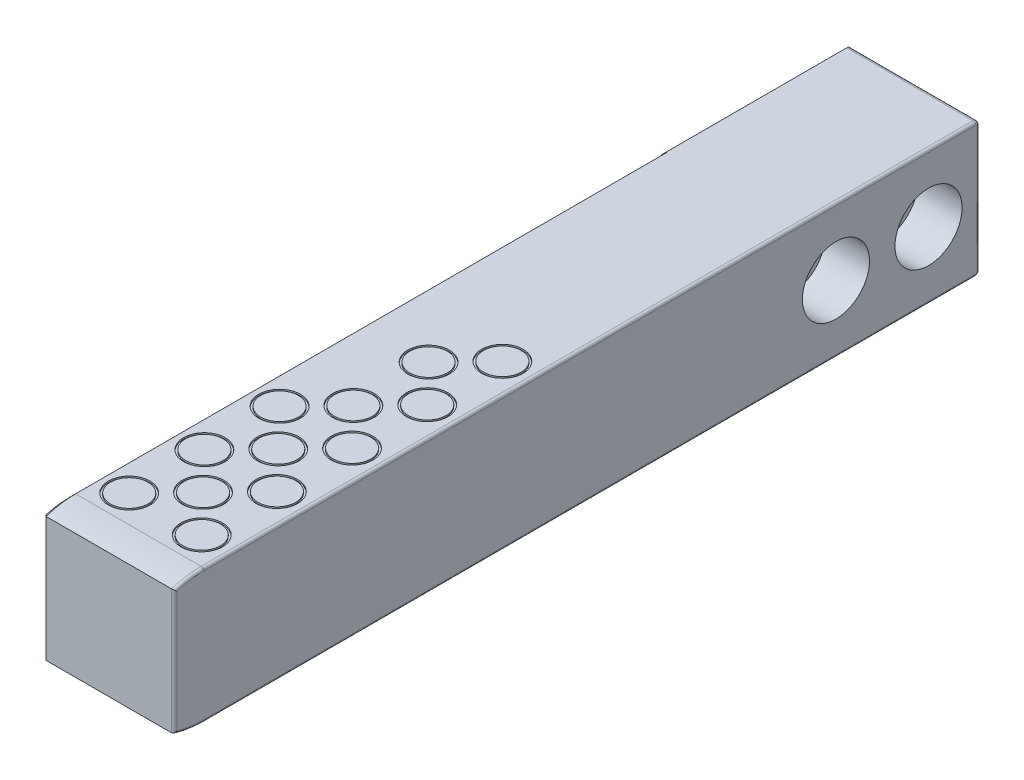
SolidWorks part; units mm, degrees
ref_plane "Front Plane" through (0, 0, 0) normal (0, 0, 1) x (1, 0, 0)
ref_plane "Top Plane" through (0, 0, 0) normal (0, 1, 0) x (1, 0, 0)
ref_plane "Right Plane" through (0, 0, 0) normal (1, 0, 0) x (0, 0, -1)
sketch "Sketch1" plane through (0, 0, 0) normal (1, 0, 0) x (0, 0, -1)
  line L0 (0, 0) -> (-117.475, 0) construction
  line L1 (-111.887, -12.7) -> (34.163, -12.7)
  line L2 (-117.475, -11.7991) -> (-117.475, 11.7991)
  line L3 (-111.887, 12.7) -> (34.163, 12.7)
  line L4 (34.925, -11.938) -> (34.925, 11.938)
  line L5 (0, 0) -> (-13.4495, 0) construction
  arc A0 (34.163, -12.7) -> (34.925, -11.938) centre (34.163, -11.938) ccw
  arc A1 (34.163, 12.7) -> (34.925, 11.938) centre (34.163, 11.938) cw
  arc A2 (-111.887, 12.7) -> (-117.475, 11.7991) centre (-111.887, -5.08) ccw
  arc A3 (-111.887, -12.7) -> (-117.475, -11.7991) centre (-111.887, 5.08) cw
  circle A6 centre (25.273, 0) radius 4.318
  circle A7 centre (7.747, 0) radius 4.318
  point P17 (-117.475, -11.7991)
  point P20 (-117.475, 11.7991)
  dimension "D5" = 0.762
  dimension "D9" = 17.78
  dimension "D7" = 8.636
  dimension "D10" = 8.636
  dimension "D2" = 152.4
  dimension "D3" = 34.925
  dimension "D6" = 5.588
  dimension "D8" = 9.652
  dimension "D11" = 17.526
  dimension "D12" = 25.4
extrude "Boss-Extrude1" add sketch "Sketch1" against normal blind 25.4
sketch "Sketch2" plane through (0, 12.7, 0) normal (0, 1, 0) x (1, 0, 0)
  line L0 (-25.4, 34.163) -> (-25.4, -111.887) construction
  line L1 (0, 34.163) -> (0, -111.887) construction
  line L2 (-12.446, -99.568) -> (5.5051, -99.568) construction
  line L3 (-5.588, -92.456) -> (-28.5049, -92.456) construction
  line L4 (-12.446, -85.344) -> (3.2168, -85.344) construction
  circle A0 centre (-19.304, -106.68) radius 3.937
  circle A1 centre (-19.304, -106.68) radius 3.556
  circle A2 centre (-12.446, -99.568) radius 3.937
  circle A3 centre (-12.446, -99.568) radius 3.556
  circle A4 centre (-5.588, -106.68) radius 3.556
  circle A5 centre (-5.588, -106.68) radius 3.937
  circle A6 centre (-5.588, -92.456) radius 3.937
  circle A7 centre (-5.588, -92.456) radius 3.556
  circle A8 centre (-12.446, -85.344) radius 3.556
  circle A9 centre (-12.446, -85.344) radius 3.937
  circle A10 centre (-5.588, -78.232) radius 3.556
  circle A11 centre (-5.588, -78.232) radius 3.937
  dimension "D1" = 106.68
  dimension "D2" = 5.588
  dimension "D5" = 7.874
  dimension "D7" = 12.954
  dimension "D8" = 7.112
  dimension "D3" = 7.112
  dimension "D4" = 6.858
  dimension "D9" = 12.446
  dimension "D6" = 6.858
extrude "Cut-Extrude1" cut sketch "Sketch2" against normal blind 0.2794
pattern_linear "LPattern2" count 3 spacing 14.224 along (0, 0, -1) of "Cut-Extrude1"
mirror "Mirror1" about plane through (0, 0, 0) normal (0, 1, 0) of "LPattern2", "Cut-Extrude1"
fillet "Fillet3" radius 0.508 10 edges at (0, 0, 117.475) (0, 12.4733, 114.7171) (0, 12.7, 38.862) (0, 12.4768, -34.7018) (0, 0, -34.925) (0, -12.4768, -34.7018) (0, -12.7, 38.862) (0, -12.4733, 114.7171) (0, 0, -29.591) (0, 0, -12.065)
ref_plane "Plane1" through (0, 0, -44.45) normal (0, 0, 1) x (1, 0, 0)
ref_plane "Plane2" through (0, 0, -15.875) normal (0, 0, 1) x (1, 0, 0)
sketch "Sketch4" plane through (0, 0, 0) normal (0, 1, 0) x (1, 0, 0)
  line L0 (-25.4, 25.273) -> (-0.508, 25.273) construction
  line L2 (-8.382, 25.273) -> (0, 25.273)
  line L4 (-8.382, 25.273) -> (-8.382, 31.623)
  line L5 (-8.382, 31.623) -> (0, 31.623)
  line L8 (0, 25.273) -> (0, 31.623)
  line L9 (0, 34.163) -> (0, -111.887) construction
  dimension "D1" = 6.35
  dimension "D2" = 8.382
revolve "Cut-Revolve1" cut sketch "Sketch4" angle 360 about axis through (-25.4, 0, -25.273) along (1, 0, 0)
pattern_linear "LPattern3" count 2 spacing 17.526 along (0, 0, 1) of "Cut-Revolve1"
sketch "Sketch5" plane through (-25.4, 0, 0) normal (-1, 0, 0) x (0, 0, 1)
  line L1 (0, -19.05) -> (127, -19.05)
  line L2 (0, -19.05) -> (0, 19.05)
  line L3 (0, 19.05) -> (127, 19.05)
  line L4 (127, -19.05) -> (127, 19.05)
  line L5 (13.97, 0) -> (-13.97, 0) construction
  dimension "D1" = 19.05
  dimension "D2" = 19.05
  dimension "D3" = 127
extrude "Cut-Extrude2" cut sketch "Sketch5" against normal blind 0.127
chamfer "Chamfer1" distance 1.016 angle 45 4 edges at (-25.273, -12.7, 55.9435) (-25.273, -12.4733, 114.7171) (-25.273, 12.4733, 114.7171) (-25.273, 12.7, 55.9435)
chamfer "Chamfer2" distance 1.016 angle 45 4 edges at (-25.4, -12.7, -17.0815) (-25.4, 0, -34.925) (-25.4, 12.7, -17.0815) (-25.273, 0, 117.475)
